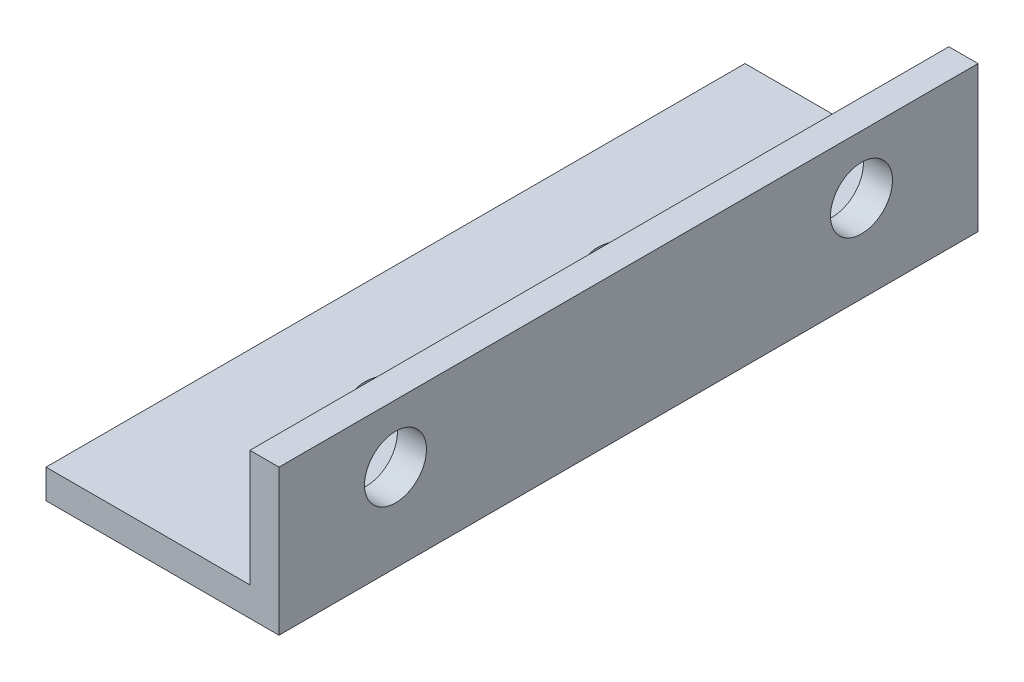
SolidWorks part; units mm, degrees
ref_plane "Front Plane" through (0, 0, 0) normal (0, 0, 1) x (1, 0, 0)
ref_plane "Top Plane" through (0, 0, 0) normal (0, 1, 0) x (1, 0, 0)
ref_plane "Right Plane" through (0, 0, 0) normal (1, 0, 0) x (0, 0, -1)
sketch "Sketch1" plane through (0, 0, 0) normal (0, 0, 1) x (1, 0, 0)
  line L6 (0, 0) -> (0, 15.875)
  line L7 (0, 15.875) -> (-3.175, 15.875)
  line L8 (-3.175, 15.875) -> (-3.175, 3.175)
  line L9 (-3.175, 3.175) -> (-25.4, 3.175)
  line L10 (-25.4, 3.175) -> (-25.4, 0)
  line L11 (-25.4, 0) -> (0, 0)
  point P15 (0, 0)
extrude "Boss-Extrude1" add sketch "Sketch1" against normal blind 76.2
sketch "Sketch2" plane through (0, 3.175, 0) normal (0, 1, 0) x (1, 0, 0)
  line L0 (0, 38.1) -> (-12.7, 38.1) construction
  line L1 (0, 76.2) -> (0, 0) construction
  line L2 (-12.7, 38.1) -> (-12.7, 50.8) construction
  line L3 (-12.7, 38.1) -> (-12.7, 25.4) construction
sketch "Sketch3" plane through (-3.175, 0, 0) normal (-1, 0, 0) x (0, 0, 1)
  line L0 (-38.1, 0) -> (-38.1, 9.525) construction
  line L1 (-76.2, 0) -> (0, 0) construction
  line L2 (-38.1, 9.525) -> (-12.7, 9.525) construction
  line L3 (-38.1, 9.525) -> (-63.5, 9.525) construction
  dimension "D1" = 9.525
  dimension "D2" = 50.8
hole_wizard "1/4 Clearance Hole1" positions "Sketch5" profile "Sketch4" hole size "1/4" standard "ANSI Inch"
sketch "Sketch5" plane through (0, 3.175, 0) normal (0, 1, 0) x (1, 0, 0)
  point P0 (-12.7, 50.8)
  point P3 (-12.7, 25.4)
sketch "Sketch4" plane through (-12.7, 3.175, -50.8) normal (1, 0, 0) x (0, 0, 1)
  line L0 (0, 0) -> (0, 3.175)
  line L1 (0, 3.175) -> (3.3782, 3.175)
  line L2 (3.3782, 3.175) -> (3.3782, 0)
  line L5 (3.3782, 0) -> (0, 0)
  line L11 (0, -6.35) -> (0, 107.95) construction
  dimension "Thru Hole Dia." = 6.7564
  dimension "Thru Hole Depth" = 3.175
hole_wizard "1/4 Clearance Hole2" positions "Sketch7" profile "Sketch6" hole size "1/4" standard "ANSI Inch"
sketch "Sketch7" plane through (-3.175, 0, 0) normal (-1, 0, 0) x (0, 0, 1)
  point P0 (-63.5, 9.525)
  point P3 (-12.7, 9.525)
sketch "Sketch6" plane through (-3.175, 9.525, -63.5) normal (0, 1, 0) x (0, 0, 1)
  line L0 (0, 0) -> (0, 3.175)
  line L1 (0, 3.175) -> (3.3782, 3.175)
  line L2 (3.3782, 3.175) -> (3.3782, 0)
  line L5 (3.3782, 0) -> (0, 0)
  line L11 (0, -6.35) -> (0, 107.95) construction
  dimension "Thru Hole Dia." = 6.7564
  dimension "Thru Hole Depth" = 3.175
